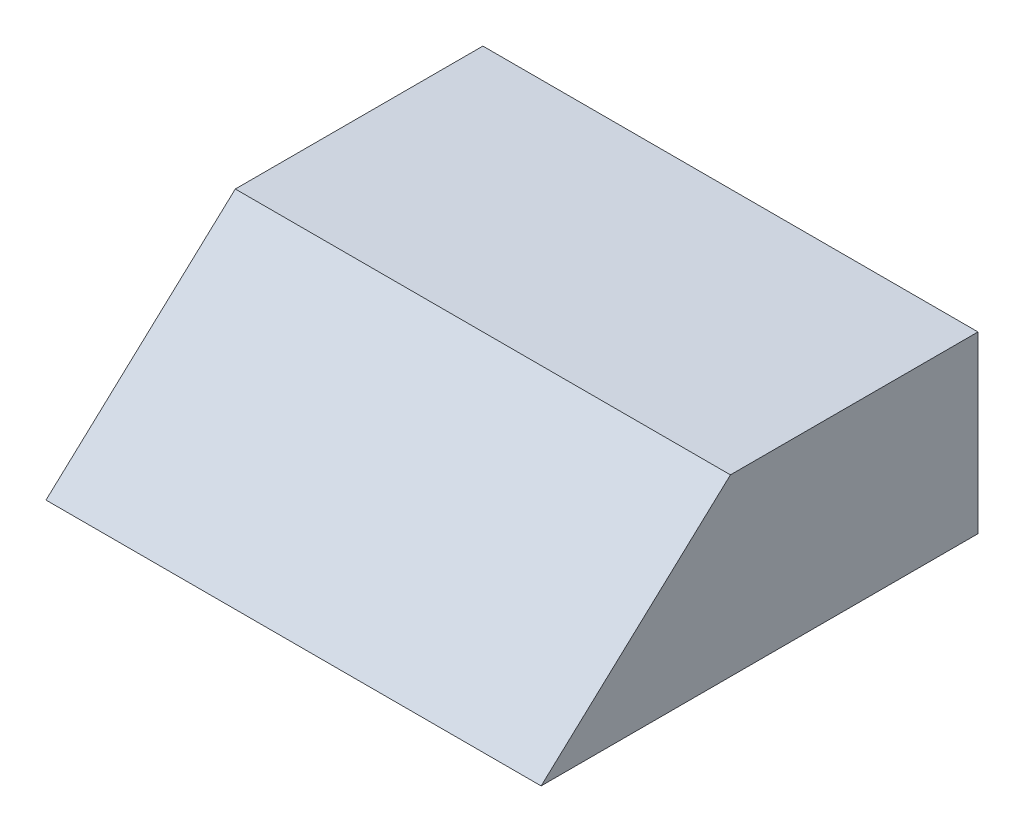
SolidWorks part; units mm, degrees
ref_plane "frontal" through (0, 0, 0) normal (0, 0, 1) x (1, 0, 0)
ref_plane "horizontal" through (0, 0, 0) normal (0, 1, 0) x (1, 0, 0)
ref_plane "profil" through (0, 0, 0) normal (1, 0, 0) x (0, 0, -1)
sketch "Esquisse1" plane through (0, 0, 0) normal (1, 0, 0) x (0, 0, -1)
  line L0 (0, 0) -> (30, 0)
  line L1 (30, 0) -> (30, 12)
  line L2 (30, 12) -> (13, 12)
  line L3 (13, 12) -> (0, 0)
  dimension "D1" = 12
  dimension "D2" = 17
  dimension "D3" = 30
extrude "viseur" add sketch "Esquisse1" along normal mid plane 34
